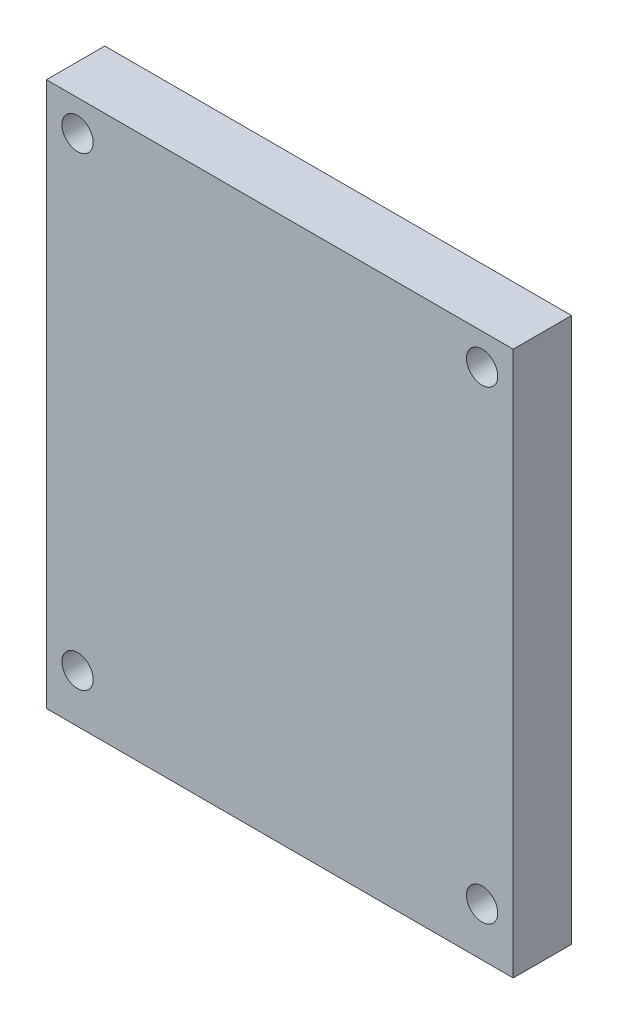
SolidWorks part; units mm, degrees
ref_plane "Front Plane" through (0, 0, 0) normal (0, 0, 1) x (1, 0, 0)
ref_plane "Top Plane" through (0, 0, 0) normal (0, 1, 0) x (1, 0, 0)
ref_plane "Right Plane" through (0, 0, 0) normal (1, 0, 0) x (0, 0, -1)
sketch "Sketch1" plane through (0, 0, 0) normal (0, 0, 1) x (1, 0, 0)
  line L1 (0, 0) -> (76.2, 0)
  line L2 (0, 0) -> (0, 88.9)
  line L3 (0, 88.9) -> (76.2, 88.9)
  line L4 (76.2, 0) -> (76.2, 88.9)
  dimension "D1" = 76.2
  dimension "D2" = 88.9
extrude "Boss-Extrude1" add sketch "Sketch1" along normal blind 9.525
hole_wizard "#10 Clearance Hole1" positions "Sketch8" profile "Sketch9" hole size "#10" standard "ANSI Inch"
sketch "Sketch8" plane through (0, 0, 9.525) normal (0, 0, 1) x (1, 0, 0)
  circle A0 centre (5.08, 83.82) radius 2.0193 construction
  circle A1 centre (71.12, 83.82) radius 2.0193 construction
  circle A2 centre (5.08, 7.9121) radius 2.0193 construction
  circle A3 centre (71.12, 7.9121) radius 2.0193 construction
  circle A4 centre (5.08, 83.82) radius 2.0193
  circle A5 centre (71.12, 83.82) radius 2.0193
  circle A6 centre (5.08, 7.9121) radius 2.0193
  circle A7 centre (71.12, 7.9121) radius 2.0193
  point P0 (71.12, 83.82)
  point P2 (5.08, 83.82)
  point P4 (5.08, 7.9121)
  point P6 (71.12, 7.9121)
sketch "Sketch9" plane through (71.12, 83.82, 9.525) normal (1, 0, 0) x (0, -1, 0)
  line L0 (0, 0) -> (0, 14.2338)
  line L1 (0, 14.2338) -> (2.5527, 12.7)
  line L2 (2.5527, 12.7) -> (2.5527, 0)
  line L5 (2.5527, 0) -> (0, 0)
  line L10 (0, 14.2338) -> (-2.5527, 12.7) construction
  line L11 (0, -6.35) -> (0, 107.95) construction
  dimension "Hole Dia." = 5.1054
  dimension "Hole Depth" = 12.7
  dimension "Drill Angle" = 118
